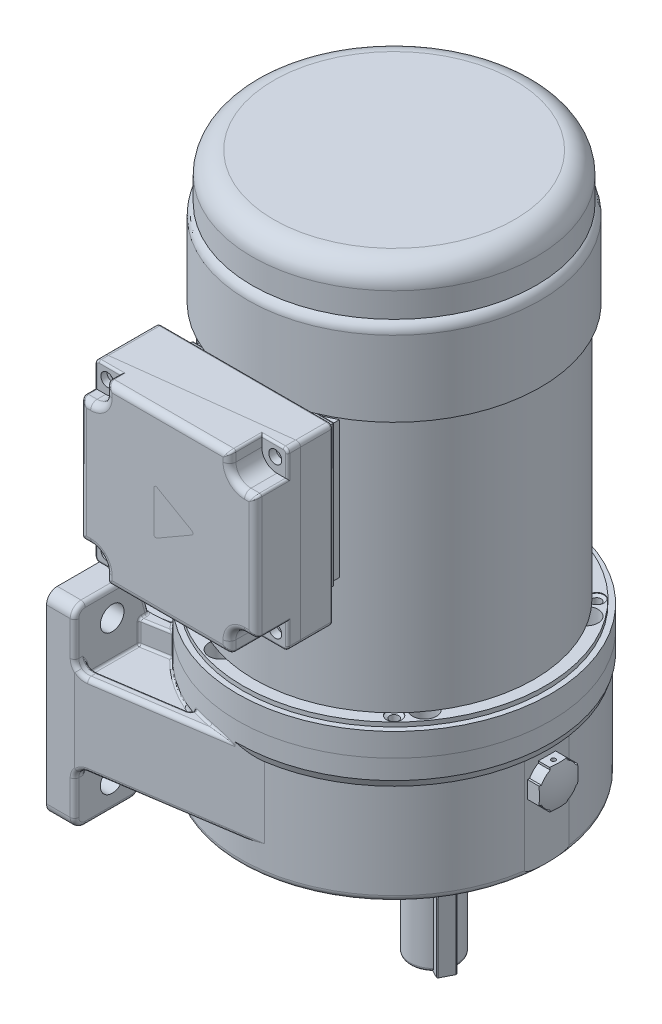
SolidWorks part; units mm, degrees
ref_plane "前视基准面" through (0, 0, 0) normal (0, 0, 1) x (1, 0, 0)
ref_plane "上视基准面" through (0, 0, 0) normal (0, 1, 0) x (1, 0, 0)
ref_plane "右视基准面" through (0, 0, 0) normal (1, 0, 0) x (0, 0, -1)
imported_body "接线盒座-1-surface1"
imported_body "接线盒座-1-surface2"
imported_body "接线盒座-1-surface3"
imported_body "接线盒座-1-surface4"
imported_body "接线盒座-1-surface5"
imported_body "接线盒座-1-surface6"
imported_body "接线盒盖-1-surface1"
imported_body "接线盒盖-1-surface2"
imported_body "接线盒盖-1-surface3"
imported_body "接线盒盖-1-surface4"
imported_body "卧式箱体装配.SLDPRT-1/15.11.08 22箱盖B-1-surface1"
imported_body "卧式箱体装配.SLDPRT-1/3轴22-1-surface1"
imported_body "卧式箱体装配.SLDPRT-1/3轴22-1-surface2"
imported_body "卧式箱体装配.SLDPRT-1/15.05.20 22卧式箱体B-2-surface1"
imported_body "卧式箱体装配.SLDPRT-1/透气塞-1-surface1"
imported_body "卧式箱体装配.SLDPRT-1/7X32-1-surface1"
imported_body "卧式箱体装配.SLDPRT-1/GB／T13871．1-2007唇形密封圈B型B1525X40X7-1-surface1"
sketch "草图2" plane through (0, -137.1427, 0) normal (0, 1, 0) x (1, 0, 0)
  circle A2 centre (262.6275, 88.1377) radius 65
extrude "凸台-拉伸2" add sketch "草图2" along normal blind 119
sketch "草图3" plane through (0, -18.1427, 0) normal (0, 1, 0) x (1, 0, 0)
  circle A0 centre (262.6275, 88.1377) radius 68
extrude "凸台-拉伸3" add sketch "草图3" along normal blind 35 separate body
sketch "草图4" plane through (0, 16.8573, 0) normal (0, 1, 0) x (1, 0, 0)
  circle A0 centre (262.6275, 88.1377) radius 68
extrude "凸台-拉伸4" add sketch "草图4" along normal blind 5 separate body
sketch "草图5" plane through (0, 21.8573, 0) normal (0, 1, 0) x (1, 0, 0)
  circle A0 centre (262.6275, 88.1377) radius 66
extrude "凸台-拉伸5" add sketch "草图5" along normal blind 21.5 separate body
fillet "圆角2" radius 10 1 edges at (262.6275, 43.3573, -22.1377)
fillet "圆角9" radius 5 1 edges at (262.6275, 21.8573, -20.1377)
